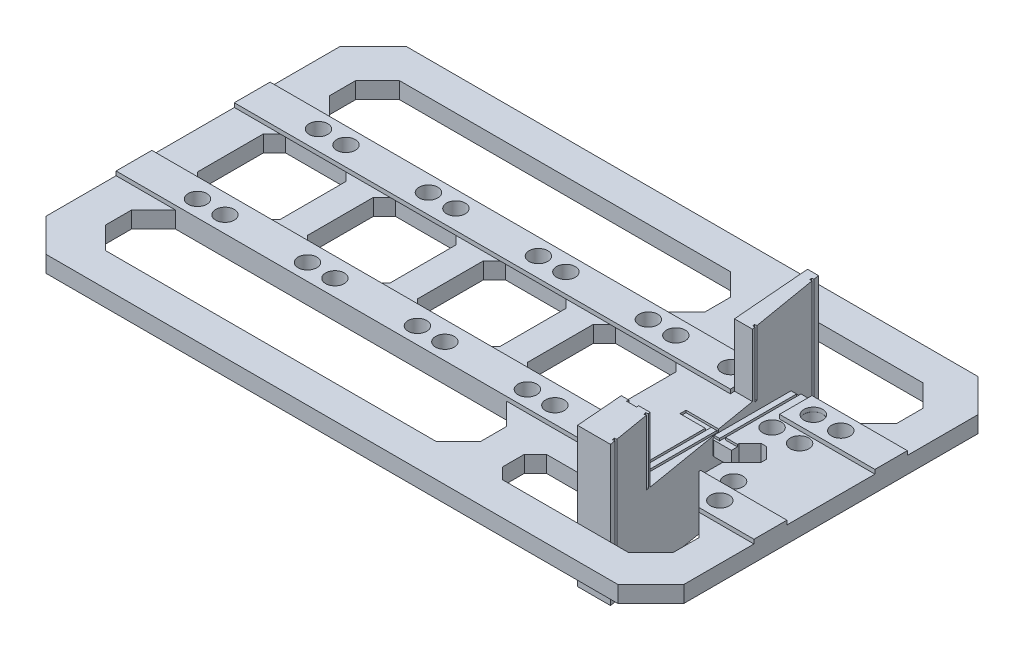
SolidWorks part; units mm, degrees
ref_plane "Front Plane" through (0, 0, 0) normal (0, 0, 1) x (1, 0, 0)
ref_plane "Top Plane" through (0, 0, 0) normal (0, 1, 0) x (1, 0, 0)
ref_plane "Right Plane" through (0, 0, 0) normal (1, 0, 0) x (0, 0, -1)
sketch "Sketch1" plane through (0, 0, 0) normal (0, 1, 0) x (1, 0, 0)
  line L0 (57.5, 0) -> (21.0339, 0) construction
  line L1 (57, -32.75) -> (-47, -32.75)
  line L2 (-53, -26.75) -> (-53, 26.75)
  line L3 (57, 32.75) -> (-47, 32.75)
  line L4 (-53, 26.75) -> (-47, 32.75)
  line L5 (-47, -32.75) -> (-53, -26.75)
  line L6 (63, -26.75) -> (57, -32.75)
  line L7 (63, 26.75) -> (57, 32.75)
  line L8 (13.8, 6) -> (13.8, -6)
  line L9 (57, 17.9) -> (53, 13.9)
  line L10 (15.8, 8) -> (13.8, 6)
  line L11 (57, -18) -> (57, -22.75)
  line L12 (22, -18) -> (22, -22.75)
  line L13 (22, 14) -> (22, 26.75) construction
  line L14 (15.8, -8) -> (13.8, -6)
  line L15 (-6.2, 6) -> (-6.2, -6)
  line L16 (57, 17.9) -> (57, 22.75)
  line L17 (53, 26.75) -> (57, 22.75)
  line L18 (36.3225, 18.75) -> (36, 22.75)
  line L19 (39.6688, -22.75) -> (39.3462, -18.75)
  line L20 (42.25, -0.5) -> (42.25, 9.5)
  line L21 (22, 18) -> (22, 22.75)
  line L22 (-46.2, 18) -> (-46.2, 22.75)
  line L23 (18, 14) -> (-42.2, 14)
  line L24 (28, 20.75) -> (28, 24.75)
  line L25 (63, -26.75) -> (63, 26.75)
  line L26 (-46.2, -18) -> (-46.2, -22.75)
  line L27 (53, 13.9) -> (42.25, 13.9)
  line L28 (28, -20.75) -> (28, -24.75)
  line L29 (28, 14) -> (28, 26.75) construction
  line L30 (28, -14) -> (28, -26.75) construction
  line L31 (22, 22.75) -> (18, 26.75)
  line L32 (30, -18.75) -> (39.3462, -18.75)
  line L33 (30, -26.75) -> (53, -26.75)
  line L34 (18, -14) -> (-42.2, -14)
  line L35 (45.6685, -22.75) -> (39.6688, -22.75)
  line L36 (53, -26.75) -> (57, -22.75)
  line L37 (47.3, -8.3) -> (47.3, -4)
  line L38 (45.6685, -22.75) -> (38, 22.75)
  line L39 (41.85, 9.9) -> (41.85, 13.5)
  line L40 (47.3, -8.3) -> (57, -18)
  line L41 (18, 26.75) -> (-42.2, 26.75)
  line L42 (18, 14) -> (22, 18)
  line L43 (22, -14) -> (22, -26.75) construction
  line L44 (18, -14) -> (22, -18)
  line L45 (45.8, -0.9) -> (42.65, -0.9)
  line L46 (22, -22.75) -> (18, -26.75)
  line L47 (28, 24.75) -> (30, 26.75)
  line L48 (28, 20.75) -> (30, 18.75)
  line L49 (30, -18.75) -> (28, -20.75)
  line L50 (30, 26.75) -> (53, 26.75)
  line L51 (28, -24.75) -> (30, -26.75)
  line L52 (38, 22.75) -> (36, 22.75)
  line L53 (30, 18.75) -> (36.3225, 18.75)
  line L54 (45.8, 0.5) -> (47.8, 2.5)
  line L55 (41.85, -0.5) -> (41.85, 13.5) construction
  line L56 (50.8, -0.5) -> (47.3, -4)
  line L57 (48.8, 2.5) -> (50.8, 0.5)
  line L58 (47.8, 2.5) -> (48.8, 2.5)
  line L59 (50.8, 0.5) -> (50.8, -0.5)
  line L60 (-4.2, 8) -> (-6.2, 6)
  line L61 (-4.2, -8) -> (-6.2, -6)
  line L62 (42.25, -0.5) -> (42.25, 13.5) construction
  line L63 (45.8, -0.9) -> (45.8, 0.5)
  line L64 (6.8, 8) -> (-4.2, 8)
  line L65 (6.8, -8) -> (-4.2, -8)
  line L66 (8.8, 6) -> (8.8, -6)
  line L67 (6.8, 8) -> (8.8, 6)
  line L68 (8.8, -6) -> (6.8, -8)
  line L69 (-26.2, 6) -> (-26.2, -6)
  line L70 (-24.2, 8) -> (-26.2, 6)
  line L71 (26.8, 8) -> (15.8, 8)
  line L72 (26.8, -8) -> (15.8, -8)
  line L73 (18, -8) -> (-39, -8) construction
  line L74 (-24.2, -8) -> (-26.2, -6)
  line L75 (18, -26.75) -> (-42.2, -26.75)
  line L76 (18, 8) -> (-39, 8) construction
  line L77 (-13.2, 8) -> (-24.2, 8)
  line L78 (-13.2, -8) -> (-24.2, -8)
  line L79 (-11.2, 6) -> (-11.2, -6)
  line L80 (-13.2, 8) -> (-11.2, 6)
  line L81 (-11.2, -6) -> (-13.2, -8)
  line L82 (-46.2, 6) -> (-46.2, -6)
  line L83 (-44.2, 8) -> (-46.2, 6)
  line L85 (-44.2, -8) -> (-46.2, -6)
  line L86 (-33.2, 8) -> (-44.2, 8)
  line L87 (-33.2, -8) -> (-44.2, -8)
  line L88 (-31.2, 6) -> (-31.2, -6)
  line L89 (-33.2, 8) -> (-31.2, 6)
  line L90 (-31.2, -6) -> (-33.2, -8)
  line L98 (-46.2, 22.75) -> (-42.2, 26.75)
  line L99 (-42.2, 14) -> (-46.2, 18)
  line L100 (-42.2, -14) -> (-46.2, -18)
  line L101 (-42.2, -26.75) -> (-46.2, -22.75)
  line L106 (18, -14) -> (-39, -14) construction
  line L107 (28.8, 6) -> (28.8, -6)
  line L108 (26.8, 8) -> (28.8, 6)
  line L109 (28.8, -6) -> (26.8, -8)
  line L113 (18, 14) -> (-39, 14) construction
  circle A0 centre (51.3, -6) radius 1.7
  circle A1 centre (51.3, 6) radius 1.7
  circle A2 centre (33.8, -11) radius 1.7
  arc A3 (42.65, -0.9) -> (42.25, -0.5) centre (42.65, -0.5) cw
  circle A4 centre (46.3, 6) radius 1.7
  circle A5 centre (23.8, 11) radius 1.7
  circle A6 centre (18.8, 11) radius 1.7
  arc A8 (41.85, 9.9) -> (42.25, 9.5) centre (42.25, 9.9) ccw
  arc A9 (42.25, 13.9) -> (41.85, 13.5) centre (42.25, 13.5) ccw
  circle A11 centre (3.8, 11) radius 1.7
  circle A12 centre (-1.2, 11) radius 1.7
  circle A15 centre (-16.2, 11) radius 1.7
  circle A16 centre (-21.2, 11) radius 1.7
  circle A17 centre (48.8, 11) radius 1.7
  circle A19 centre (-36.2, 11) radius 1.7
  circle A20 centre (-41.2, 11) radius 1.7
  circle A23 centre (53.8, -11) radius 1.7
  circle A26 centre (-41.2, -11) radius 1.7
  circle A27 centre (-36.2, -11) radius 1.7
  circle A30 centre (-21.2, -11) radius 1.7
  circle A31 centre (53.8, 11) radius 1.7
  circle A32 centre (-16.2, -11) radius 1.7
  circle A35 centre (-1.2, -11) radius 1.7
  circle A36 centre (3.8, -11) radius 1.7
  circle A39 centre (18.8, -11) radius 1.7
  circle A40 centre (23.8, -11) radius 1.7
  circle A78 centre (33.8, 11) radius 1.7
  point P2 (-53, 32.75)
  point P3 (-53, -32.75)
  point P5 (57, 26.75)
  point P15 (57, 13.9)
  point P28 (63, -32.75)
  point P31 (63, 32.75)
  point P51 (57, -26.75)
  point P52 (57, -14)
  point P83 (28, 18.75)
  point P97 (28, -18.75)
  point P106 (-4.2, 8)
  point P107 (-4.2, -8)
  point P117 (6.8, 8)
  point P121 (6.8, -8)
  point P171 (-24.2, 8)
  point P172 (-24.2, -8)
  point P173 (-13.2, 8)
  point P174 (-13.2, -8)
  point P183 (-44.2, 8)
  point P184 (-44.2, -8)
  point P185 (-33.2, 8)
  point P186 (-33.2, -8)
  point P187 (15.8, 8)
  point P188 (15.8, -8)
  point P193 (26.8, 8)
  point P194 (26.8, -8)
  point P238 (45.8, 2.5)
  point P239 (50.8, -2.5)
  point P241 (50.8, 2.5)
  dimension "D3" = 6
  dimension "D12" = 0.4
  dimension "D19" = 0.4
  dimension "D5" = 6
  dimension "D6" = 6
  dimension "D4" = 6
  dimension "D7" = 4
  dimension "D29" = 0.4
extrude "Boss-Extrude1" add sketch "Sketch1" along normal blind 3
sketch "Sketch2" plane through (0, 3, 0) normal (0, 1, 0) x (1, 0, 0)
  line L0 (43.65, 0.1843) -> (48.25, 0.1893)
  line L1 (40.75, 0.5) -> (40.75, -13.5)
  line L2 (48.25, -0.9) -> (48.25, 0.1893)
  line L5 (44.225, -0.9) -> (48.25, -0.9)
  line L6 (35.75, 0.9) -> (35.75, -0.2)
  line L7 (41.75, -13.5) -> (41.75, 0.5)
  line L8 (45.8, -0.9) -> (42.65, -0.9) construction
  line L9 (44.225, -0.9) -> (44.225, -14.1)
  line L13 (35.75, 0.5) -> (35.75, -13.5) construction
  line L14 (42.25, 13.5) -> (43.25, 13.5)
  line L15 (43.25, 13.5) -> (43.25, -0.5)
  line L16 (43.25, -0.5) -> (42.25, -0.5)
  line L17 (41.75, 0.5) -> (40.75, 0.5)
  line L18 (41.75, -13.5) -> (40.75, -13.5)
  line L19 (40.35, -14.1) -> (44.225, -14.1)
  line L22 (41.8, 0.9) -> (35.75, 0.9)
  line L25 (40.35, -14.1) -> (40.35, -0.2)
  line L28 (41.8, 0.9) -> (41.8, 13.9)
  line L31 (43.65, 13.9) -> (41.8, 13.9)
  line L33 (43.65, 0.1843) -> (43.65, 13.9)
  line L35 (35.75, -0.2) -> (40.35, -0.2)
  line L38 (42.25, -0.5) -> (42.25, 13.5)
  dimension "D3" = 5
extrude "Cut-Extrude1" cut sketch "Sketch2" against normal blind 0.4
sketch "Sketch5" plane through (0, 0, 0) normal (0, 1, 0) x (1, 0, 0)
  line L1 (45.6685, -22.75) -> (38, 22.75)
  line L2 (58, 0) -> (-77.055, 0) construction
  line L3 (39.6688, -22.75) -> (36, 22.75)
  line L6 (45.6685, -22.75) -> (39.6688, -22.75)
  line L9 (38, 22.75) -> (36, 22.75)
extrude "Boss-Extrude2" add sketch "Sketch5" against normal blind 11
sketch "Sketch7" plane through (0, 3, 0) normal (0, 1, 0) x (1, 0, 0)
  line L0 (38, 22.75) -> (40.4354, 8.3)
  line L1 (45.6685, -22.75) -> (39.6688, -22.75)
  line L2 (39.6688, -22.75) -> (38.9713, -14.1)
  line L3 (36, 22.75) -> (38, 22.75)
  line L4 (40.4354, 8.3) -> (37.1651, 8.3)
  line L6 (38.9713, -14.1) -> (44.2107, -14.1)
  line L7 (37.1651, 8.3) -> (36, 22.75)
  line L8 (44.2107, -14.1) -> (45.6685, -22.75)
extrude "Boss-Extrude3" add sketch "Sketch7" along normal blind 11.4
sketch "Sketch9" plane through (40.6788, 0, -6.856) normal (0.9861, 0, -0.1662) x (-0.1662, 0, -0.9861)
  line L0 (15.1182, 14.4) -> (14.7182, 14.4)
  line L1 (15.1182, 14.4) -> (15.1182, -11)
  line L2 (14.7182, 14.4) -> (14.7182, -11)
  line L3 (15.1182, -11) -> (14.7182, -11)
  line L4 (-28.6235, 14.4) -> (-28.6235, -11)
  line L5 (-29.0235, 14.4) -> (-29.0235, -11)
  line L6 (-28.6235, 14.4) -> (-29.0235, 14.4)
  line L7 (-28.6235, -11) -> (-29.0235, -11)
  line L8 (-21.6487, 2.6) -> (-22.0487, 2.6)
  line L9 (-30.0235, 14.4) -> (-30.0235, -11) construction
  line L10 (-21.6487, 14.8) -> (-22.0487, 14.8)
  line L11 (2.465, 14.7985) -> (2.065, 14.7991)
  line L12 (2.4644, 14.3985) -> (2.4467, 2.6) construction
  line L13 (-22.0487, 14.4) -> (-22.0487, 2.6) construction
  line L14 (2.0467, 2.6) -> (2.4467, 2.6)
  line L21 (16.1182, 14.4) -> (16.1182, -11) construction
  line L23 (-21.6487, 14.8) -> (-21.6487, 2.6)
  line L24 (2.065, 14.7991) -> (2.0467, 2.6)
  line L27 (-21.6487, 14.4) -> (-21.6487, 2.6) construction
  line L32 (-22.0487, 14.8) -> (-22.0487, 2.6)
  line L33 (2.465, 14.7985) -> (2.4467, 2.6)
  line L50 (2.0644, 14.3991) -> (2.0467, 2.6006) construction
  dimension "D3" = 1
  dimension "D4" = 1
  dimension "D1" = 0.4
  dimension "D2" = 0.4
  dimension "D10" = 0.4
  dimension "D11" = 0.4
extrude "Cut-Extrude5" cut sketch "Sketch9" against normal blind 0.4
sketch "Sketch10" plane through (0, 0, 14.1) normal (0, 0, -1) x (-1, 0, 0)
  line L0 (-42.15, 2.6) -> (-42.15, 14.4)
  line L2 (-40.35, 2.6) -> (-40.35, 14.4)
  line L3 (-40.35, 2.6) -> (-42.15, 2.6)
  line L4 (-42.15, 14.4) -> (-40.35, 14.4)
extrude "Cut-Extrude6" cut sketch "Sketch10" against normal blind 0.4
sketch "Sketch11" plane through (0, 3, 0) normal (0, 1, 0) x (1, 0, 0)
  line L0 (45.65, 13.9) -> (45.65, 8)
  line L1 (53, -14) -> (47.3, -8.3)
  line L2 (-53, 7.5) -> (-53, 14)
  line L3 (-53, 14) -> (36.7055, 14)
  line L4 (63, 8) -> (63, 13.9)
  line L5 (-53, 7.5) -> (37.2296, 7.5)
  line L6 (-53, 26.75) -> (-53, -26.75) construction
  line L7 (-53, -14) -> (36.8, -14)
  line L8 (-53, -14) -> (-53, -7.5)
  line L9 (57, -18) -> (47.3, -8.3) construction
  line L10 (63, -14) -> (63, -8)
  line L11 (63, -26.75) -> (63, 26.75) construction
  line L13 (45.65, 13.9) -> (63, 13.9)
  line L16 (45.65, 8) -> (63, 8)
  line L17 (53, -14) -> (63, -14)
  line L18 (47.3, -8) -> (63, -8)
  line L19 (36.8, -7.5) -> (36.8, -14)
  line L20 (-53, -7.5) -> (36.8, -7.5)
  line L21 (47.3, -8.3) -> (47.3, -8)
  line L22 (36.7055, 14) -> (37.2296, 7.5)
  circle A0 centre (-41.2, 11) radius 1.7
  circle A1 centre (-41.2, -11) radius 1.7
  circle A2 centre (-36.2, 11) radius 1.7
  circle A3 centre (-36.2, -11) radius 1.7
  circle A8 centre (-21.2, 11) radius 1.7
  circle A9 centre (-21.2, -11) radius 1.7
  circle A10 centre (-16.2, 11) radius 1.7
  circle A11 centre (-16.2, -11) radius 1.7
  circle A16 centre (-1.2, 11) radius 1.7
  circle A17 centre (-1.2, -11) radius 1.7
  circle A18 centre (3.8, 11) radius 1.7
  circle A19 centre (3.8, -11) radius 1.7
  circle A24 centre (18.8, 11) radius 1.7
  circle A25 centre (18.8, -11) radius 1.7
  circle A26 centre (23.8, 11) radius 1.7
  circle A27 centre (23.8, -11) radius 1.7
  circle A30 centre (33.8, 11) radius 1.7
  circle A31 centre (33.8, -11) radius 1.7
  circle A32 centre (48.8, 11) radius 1.7113
  circle A38 centre (53.8, 11) radius 1.7
  circle A39 centre (53.8, -11) radius 1.7
extrude "Boss-Extrude4" add sketch "Sketch11" along normal blind 0.75
